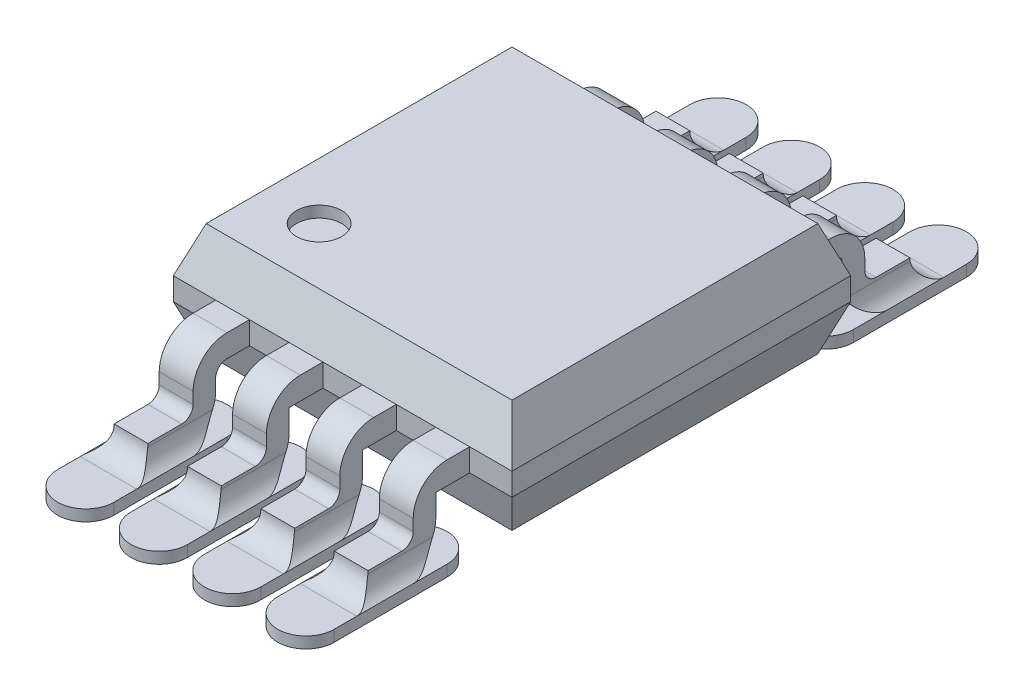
SolidWorks part; units mm, degrees
ref_plane "Plan de face" through (0, 0, 0) normal (0, 0, 1) x (1, 0, 0)
ref_plane "Plan de dessus" through (0, 0, 0) normal (0, 1, 0) x (1, 0, 0)
ref_plane "Plan de droite" through (0, 0, 0) normal (1, 0, 0) x (0, 0, -1)
sketch "Esquisse1" plane through (0, 0, 0) normal (0, 1, 0) x (1, 0, 0)
  line L1 (0, 0) -> (3, 0)
  line L2 (0, 0) -> (0, 3)
  line L3 (0, 3) -> (3, 3)
  line L4 (3, 0) -> (3, 3)
  dimension "D1" = 3
  dimension "D2" = 3
extrude "Boss.-Extru.1" add sketch "Esquisse1" along normal blind 0.2
sketch "Esquisse2" plane through (0, 0, 0) normal (0, 0, 1) x (1, 0, 0)
  line L0 (0, 0.2) -> (0.1456, 0.6)
  line L1 (0.1456, 0.6) -> (2.8544, 0.6)
  line L2 (2.8544, 0.6) -> (3, 0.2)
  line L3 (3, 0.2) -> (0, 0.2)
  line L4 (0, 0) -> (0.1456, -0.4)
  line L5 (0.1456, -0.4) -> (2.8544, -0.4)
  line L6 (2.8544, -0.4) -> (3, 0)
  line L7 (3, 0) -> (0, 0)
  dimension "D1" = 0.4
  dimension "D2" = 0.4
  dimension "D3" = 70
  dimension "D4" = 70
  dimension "D5" = 70
  dimension "D6" = 70
extrude "Boss.-Extru.2" add sketch "Esquisse2" against normal up to surface (3 mm away)
sketch "Esquisse3" plane through (3, 0, 0) normal (1, 0, 0) x (0, 0, -1)
  line L0 (0, 0.2) -> (0.1456, 0.6)
  line L1 (3, 0.6) -> (0, 0.6) construction
  line L2 (0.1456, 0.6) -> (0, 0.6)
  line L3 (0, 0.6) -> (0, 0.2)
  line L4 (0, 0) -> (0, -0.4)
  line L5 (0, -0.4) -> (0.1456, -0.4)
  line L6 (3, -0.4) -> (0, -0.4) construction
  line L7 (0.1456, -0.4) -> (0, 0)
  line L8 (3, 0.2) -> (3, 0.6)
  line L9 (3, 0.6) -> (2.8544, 0.6)
  line L10 (2.8544, 0.6) -> (3, 0.2)
  line L11 (3, 0) -> (3, -0.4)
  line L12 (3, -0.4) -> (2.8544, -0.4)
  line L13 (2.8544, -0.4) -> (3, 0)
  line L14 (0, 0.2) -> (3, 0.2) construction
  line L15 (0, 0) -> (3, 0) construction
  dimension "D1" = 70
  dimension "D2" = 70
  dimension "D3" = 70
  dimension "D4" = 70
extrude "Enlèv. mat.-Extru.1" cut sketch "Esquisse3" against normal through all
sketch "Esquisse4" plane through (0, 0, -3) normal (0, 0, -1) x (-1, 0, 0)
  line L0 (0, 0.2) -> (-3, 0.2) construction
  line L1 (-2.625, 0.2) -> (-2.325, 0.2)
  line L2 (-2.625, 0.2) -> (-2.625, 0)
  line L3 (-2.625, 0) -> (-2.325, 0)
  line L4 (-2.325, 0.2) -> (-2.325, 0)
  line L5 (0, 0) -> (-3, 0) construction
  line L6 (-2.625, 0.2) -> (-3, 0) construction
  line L7 (-1.975, 0.2) -> (-1.675, 0.2)
  line L8 (-1.975, 0.2) -> (-1.975, 0)
  line L9 (-1.975, 0) -> (-1.675, 0)
  line L10 (-1.675, 0.2) -> (-1.675, 0)
  line L11 (-1.325, 0.2) -> (-1.025, 0.2)
  line L12 (-1.325, 0.2) -> (-1.325, 0)
  line L13 (-1.325, 0) -> (-1.025, 0)
  line L14 (-1.025, 0.2) -> (-1.025, 0)
  line L15 (-0.675, 0.2) -> (-0.375, 0.2)
  line L16 (-0.675, 0.2) -> (-0.675, 0)
  line L17 (-0.675, 0) -> (-0.375, 0)
  line L18 (-0.375, 0.2) -> (-0.375, 0)
  line L19 (-0.375, 0.2) -> (0, 0) construction
  dimension "D1" = 0.3
  dimension "D2" = 0.35
  dimension "D3" = 0.35
  dimension "D4" = 0.35
extrude "Boss.-Extru.3" add sketch "Esquisse4" along normal blind 0.5
sketch "Esquisse5" plane through (0, 0, 0) normal (0, 0, 1) x (1, 0, 0)
  line L1 (0.375, 0.2) -> (0.675, 0.2)
  line L2 (0.375, 0.2) -> (0.375, 0)
  line L3 (0.375, 0) -> (0.675, 0)
  line L4 (0.675, 0.2) -> (0.675, 0)
  line L5 (1.025, 0.2) -> (1.325, 0.2)
  line L6 (1.025, 0.2) -> (1.025, 0)
  line L7 (1.025, 0) -> (1.325, 0)
  line L8 (1.325, 0.2) -> (1.325, 0)
  line L9 (1.675, 0.2) -> (1.975, 0.2)
  line L10 (1.675, 0.2) -> (1.675, 0)
  line L11 (1.675, 0) -> (1.975, 0)
  line L12 (1.975, 0.2) -> (1.975, 0)
  line L13 (2.325, 0.2) -> (2.625, 0.2)
  line L14 (2.325, 0.2) -> (2.325, 0)
  line L15 (2.325, 0) -> (2.625, 0)
  line L16 (2.625, 0.2) -> (2.625, 0)
extrude "Boss.-Extru.4" add sketch "Esquisse5" along normal blind 0.5
sketch "Esquisse6" plane through (0, 0, 0) normal (0, -1, 0) x (1, 0, 0)
  line L0 (0.675, 0.5) -> (0.675, 0) construction
  line L1 (0.375, 0.5) -> (0.675, 0.5)
  line L2 (0.375, 0.5) -> (0.375, 0.3)
  line L3 (0.375, 0.3) -> (0.675, 0.3)
  line L4 (0.675, 0.5) -> (0.675, 0.3)
  line L5 (0.675, -3.5) -> (0.675, -3) construction
  line L6 (0.375, -3.5) -> (0.675, -3.5)
  line L7 (0.375, -3.5) -> (0.375, -3.3)
  line L8 (0.375, -3.3) -> (0.675, -3.3)
  line L9 (0.675, -3.5) -> (0.675, -3.3)
  dimension "D1" = 0.2
  dimension "D2" = 0.2
extrude "Boss.-Extru.5" add sketch "Esquisse6" along normal blind 0.3
sketch "Esquisse7" plane through (0, -0.3, 0) normal (0, -1, 0) x (1, 0, 0)
  line L0 (0.675, -3.5) -> (0.675, -3.3) construction
  line L1 (0.375, 0.3) -> (0.675, 0.3)
  line L2 (0.375, 0.3) -> (0.375, 0.9)
  line L3 (0.375, 0.9) -> (0.675, 0.9)
  line L4 (0.675, 0.3) -> (0.675, 0.9)
  line L5 (0.375, -3.3) -> (0.675, -3.3)
  line L6 (0.375, -3.3) -> (0.375, -3.9)
  line L7 (0.375, -3.9) -> (0.675, -3.9)
  line L8 (0.675, -3.3) -> (0.675, -3.9)
  line L9 (0.675, 0.3) -> (0.675, 0.5) construction
  dimension "D1" = 0.6
  dimension "D2" = 0.6
extrude "Boss.-Extru.6" add sketch "Esquisse7" along normal blind 0.2
sketch "Esquisse8" plane through (0, -0.5, 0) normal (0, -1, 0) x (1, 0, 0)
  line L0 (0.275, 0.3) -> (0.275, 1.3)
  line L1 (0.775, 1.3) -> (0.775, 0.3)
  line L2 (0.375, 0.3) -> (0.675, 0.3) construction
  line L3 (0.675, 0.9) -> (0.375, 0.9) construction
  line L4 (0.275, -3.3) -> (0.275, -4.3)
  line L5 (0.775, -3.3) -> (0.775, -4.3)
  line L6 (0.675, -3.3) -> (0.375, -3.3) construction
  arc A0 (0.275, 1.3) -> (0.775, 1.3) centre (0.525, 1.3) cw
  arc A1 (0.275, 0.3) -> (0.775, 0.3) centre (0.525, 0.3) ccw
  arc A2 (0.275, -3.3) -> (0.775, -3.3) centre (0.525, -3.3) cw
  arc A3 (0.775, -4.3) -> (0.275, -4.3) centre (0.525, -4.3) cw
  point P10 (0.525, 0.9)
  point P19 (0.525, -3.3)
  dimension "D1" = 0.25
  dimension "D2" = 1
  dimension "D3" = 1
extrude "Boss.-Extru.7" add sketch "Esquisse8" along normal blind 0.1
fillet "Congé1" radius 0.1 4 edges at (0.525, 0, 0.3) (0.525, 0, -3.3)
fillet "Congé2" radius 0.3 2 edges at (0.525, 0.2, 0.5) (0.525, 0.2, -3.5)
sketch "Esquisse9" plane through (0.375, 0, 0) normal (-1, 0, 0) x (0, 0, 1)
  line L0 (-3.3, -0.5) -> (-3.3, -0.2)
  line L1 (-3.3, -0.5) -> (-3.3, -0.1) construction
  line L2 (-3.3, -0.5) -> (-3.6, -0.5)
  line L3 (-3.3, -0.5) -> (-3.9, -0.5) construction
  line L4 (0.3, -0.5) -> (0.3, -0.2)
  line L5 (0.3, -0.5) -> (0.3, -0.1) construction
  line L6 (0.3, -0.5) -> (0.6, -0.5)
  line L7 (0.9, -0.5) -> (0.3, -0.5) construction
  arc A0 (-3.3, -0.2) -> (-3.6, -0.5) centre (-3.6, -0.2) cw
  arc A1 (0.3, -0.2) -> (0.6, -0.5) centre (0.6, -0.2) ccw
  dimension "D1" = 0.3
  dimension "D2" = 0.3
extrude "Enlèv. mat.-Extru.2" cut sketch "Esquisse9" against normal through all
pattern_linear "Répétition linéaire2" count 4 spacing 0.65 along (1, 0, 0) of "Boss.-Extru.5", "Boss.-Extru.6", "Boss.-Extru.7"
pattern_linear "Répétition linéaire3" count 4 spacing 0.65 of "Enlèv. mat.-Extru.2"
fillet "Congé3" radius 0.3 6 edges at (1.175, 0.2, 0.5) (1.825, 0.2, 0.5) (2.475, 0.2, 0.5) (2.475, 0.2, -3.5) (1.825, 0.2, -3.5) (1.175, 0.2, -3.5)
fillet "Congé4" radius 0.1 6 edges
fillet "Congé5" radius 0.2 40 edges at (0.375, -0.4, 0.9) (0.675, -0.4, 0.9) (0.375, -0.5, 0.75) (0.525, -0.5, 0.9) (0.375, -0.4, -3.9) (0.675, -0.4, -3.9) (0.525, -0.5, -3.9) (0.675, -0.5, -3.75) (0.375, -0.5, -3.75) (0.675, -0.5, 0.75) (1.025, -0.4, 0.9) (1.325, -0.4, 0.9) (1.025, -0.5, 0.75) (1.175, -0.5, 0.9) (1.025, -0.4, -3.9) (1.325, -0.4, -3.9) (1.175, -0.5, -3.9) (1.325, -0.5, -3.75) (1.675, -0.4, 0.9) (1.975, -0.4, 0.9) (1.675, -0.5, 0.75) (1.825, -0.5, 0.9) (1.675, -0.4, -3.9) (1.975, -0.4, -3.9) (1.825, -0.5, -3.9) (1.975, -0.5, -3.75) (2.325, -0.4, 0.9) (2.625, -0.4, 0.9) (2.325, -0.5, 0.75) (2.475, -0.5, 0.9) (2.325, -0.4, -3.9) (2.625, -0.4, -3.9) (2.475, -0.5, -3.9) (2.625, -0.5, -3.75) (2.325, -0.5, -3.75) (1.675, -0.5, -3.75) (1.025, -0.5, -3.75) (2.625, -0.5, 0.75) (1.975, -0.5, 0.75) (1.325, -0.5, 0.75)
sketch "Esquisse10" plane through (0, 0.6, 0) normal (0, 1, 0) x (1, 0, 0)
  line L0 (0.1456, 2.8544) -> (0.1456, 0.1456) construction
  line L1 (0.1456, 0.1456) -> (2.8544, 0.1456) construction
  circle A0 centre (0.6456, 0.6456) radius 0.2
  dimension "D1" = 0.4
  dimension "D2" = 0.5
  dimension "D3" = 0.5
extrude "Enlèv. mat.-Extru.3" cut sketch "Esquisse10" against normal blind 0.1
